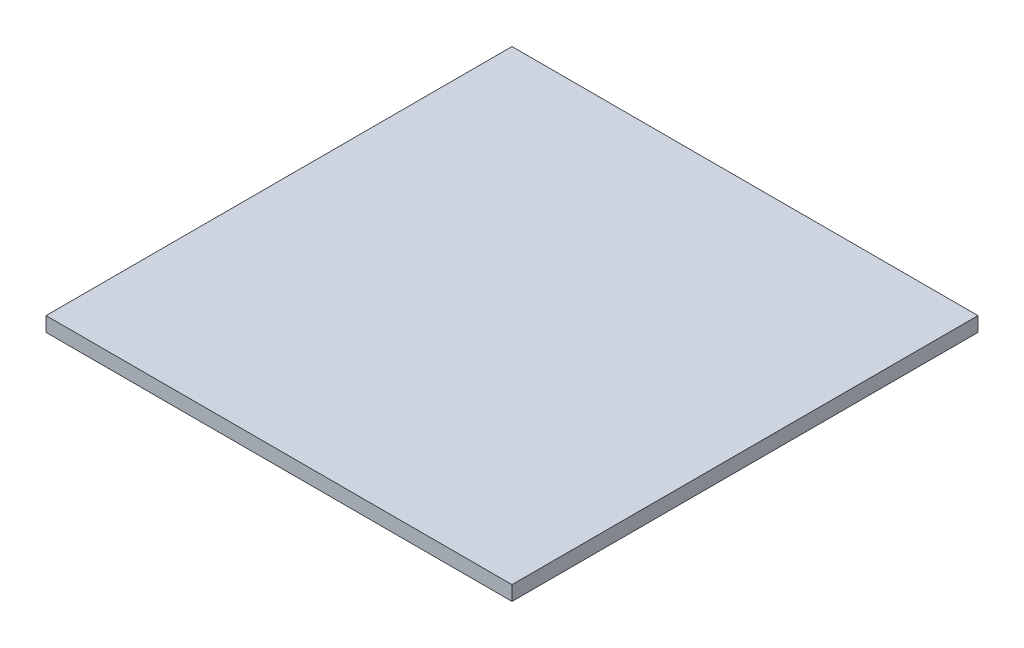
SolidWorks part; units mm, degrees
ref_plane "Front" through (0, 0, 0) normal (0, 0, 1) x (1, 0, 0)
ref_plane "Top" through (0, 0, 0) normal (0, 1, 0) x (1, 0, 0)
ref_plane "Right" through (0, 0, 0) normal (1, 0, 0) x (0, 0, -1)
sketch "Sketch1" plane through (0, 0, 0) normal (0, 1, 0) x (1, 0, 0)
  line L0 (203.2, 203.2) -> (-203.2, -203.2) construction
  line L1 (-203.2, 203.2) -> (203.2, 203.2)
  line L2 (-203.2, 203.2) -> (-203.2, -203.2)
  line L3 (-203.2, -203.2) -> (203.2, -203.2)
  line L4 (203.2, 203.2) -> (203.2, -203.2)
  point P4 (0, 0)
  dimension "D1" = 406.4
  dimension "D2" = 406.4
extrude "Extrude1" add sketch "Sketch1" along normal blind 12.7
